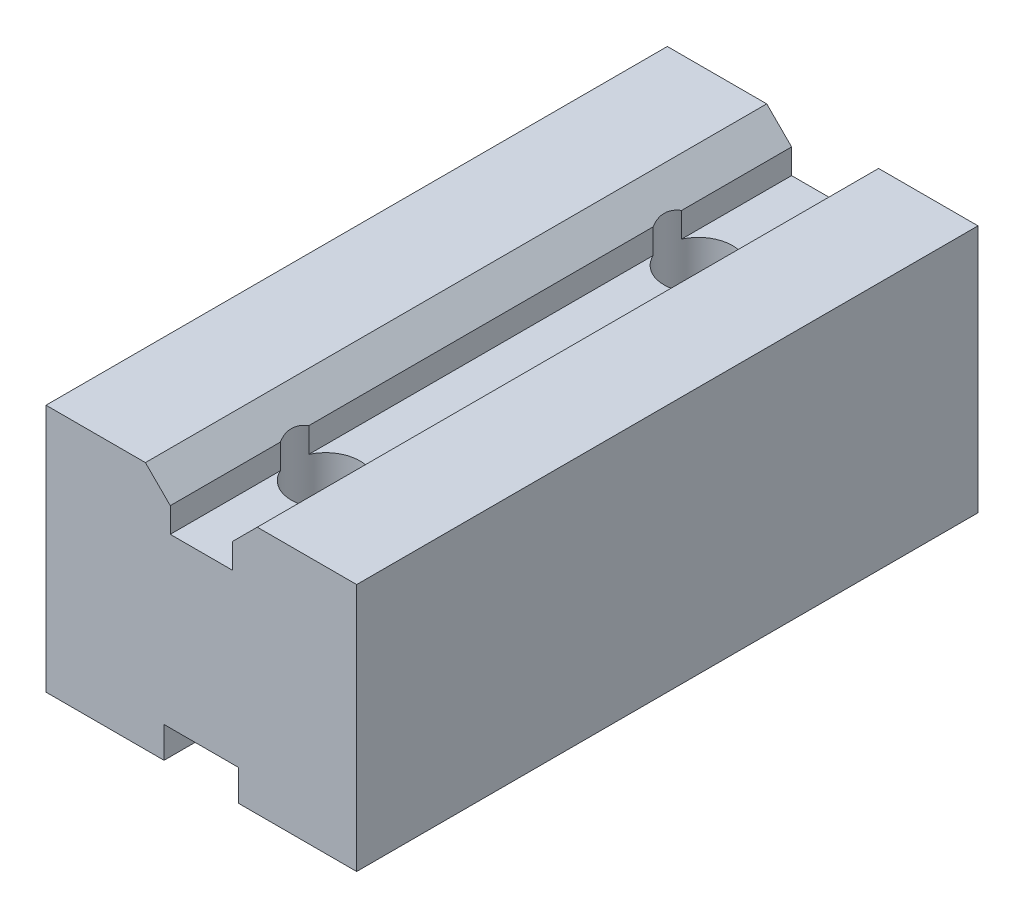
SolidWorks part; units mm, degrees
ref_plane "Ebene vorne" through (0, 0, 0) normal (0, 0, 1) x (1, 0, 0)
ref_plane "Ebene oben" through (0, 0, 0) normal (0, 1, 0) x (1, 0, 0)
ref_plane "Ebene rechts" through (0, 0, 0) normal (1, 0, 0) x (0, 0, -1)
sketch "Skizze1" plane through (0, 0, 0) normal (0, 0, 1) x (1, 0, 0)
  line L0 (0, 10.1887) -> (0, -17.0748) construction
  line L1 (12.5, -13.4678) -> (-12.5, -13.4678)
  line L2 (-12.5, -13.4678) -> (-12.5, 6.5322)
  line L3 (-12.5, 6.5322) -> (-4.5, 6.5322)
  line L4 (-4.5, 6.5322) -> (-2.5, 4.5322)
  line L5 (-2.5, 4.5322) -> (-2.5, 2.5322)
  line L6 (-2.5, 2.5322) -> (2.5, 2.5322)
  line L7 (2.5, 4.5322) -> (2.5, 2.5322)
  line L8 (4.5, 6.5322) -> (2.5, 4.5322)
  line L9 (12.5, 6.5322) -> (4.5, 6.5322)
  line L10 (12.5, -13.4678) -> (12.5, 6.5322)
  point P11 (0, 2.5322)
  point P15 (0, -13.4678)
  dimension "D1" = 25
  dimension "D2" = 20
  dimension "D3" = 4
  dimension "D4" = 2
  dimension "D5" = 45
  dimension "D6" = 5
extrude "Aufsatz-Linear austragen1" add sketch "Skizze1" along normal mid plane 50
sketch "Skizze2" plane through (0, 0, 25) normal (0, 0, 1) x (1, 0, 0)
  line L0 (0, 2.5322) -> (0, -13.4678) construction
  line L1 (2.5, 2.5322) -> (-2.5, 2.5322) construction
  line L2 (-12.5, -13.4678) -> (12.5, -13.4678) construction
  line L3 (-3, -13.4678) -> (-3, -10.9678)
  line L4 (-3, -10.9678) -> (3, -10.9678)
  line L5 (3, -10.9678) -> (3, -13.4678)
  line L6 (3, -13.4678) -> (-3, -13.4678)
  dimension "D1" = 2.5
  dimension "D2" = 6
extrude "Schnitt-Linear austragen1" cut sketch "Skizze2" against normal through all
hole_wizard "Stirnsenkung für M2.5 Zylinderschraube mit Innensechskant1" positions "Skizze5" profile "Skizze4" counterbore size "M2.5" standard "DIN"
sketch "Skizze5" plane through (0, 6.5322, 0) normal (0, 1, 0) x (1, 0, 0)
  line L0 (0, -25) -> (0, 25) construction
  line L1 (2.5, -25) -> (-2.5, -25) construction
  line L2 (2.5, 25) -> (-2.5, 25) construction
  line L4 (-12.5, 0) -> (12.5, 0) construction
  line L5 (-12.5, -25) -> (-12.5, 25) construction
  line L6 (12.5, -25) -> (12.5, 25) construction
  point P0 (0, 15)
  point P18 (0, -15)
  dimension "D1" = 30
sketch "Skizze4" plane through (0, 6.5322, -15) normal (1, 0, 0) x (0, 0, 1)
  line L0 (0, 0) -> (0, 20)
  line L1 (0, 20) -> (1.45, 20)
  line L3 (1.45, 20) -> (1.45, 10)
  line L4 (1.45, 10) -> (2.75, 10)
  line L5 (2.75, 10) -> (2.75, 0)
  line L7 (2.75, 0) -> (0, 0)
  line L11 (0, -6.35) -> (0, 107.95) construction
  dimension "Bohrerdurchmesser" = 2.9
  dimension "Bohrungstiefe" = 20
  dimension "Senkdurchmesser2" = 5.5
  dimension "Senktiefe2" = 10
sketch "Skizze6" [suppressed] plane through (0, 0, 27.5) normal (0, 0, 1) x (1, 0, 0)
  line L0 (0, 2.5322) -> (0, -16.4484) construction
  line L1 (2.5, 2.5322) -> (-2.5, 2.5322) construction
  line L2 (-3, -13.4678) -> (-3, -15.9678)
  line L3 (-12.5, -13.4678) -> (12.5, -13.4678) construction
  line L4 (-3, -15.9678) -> (3, -15.9678)
  line L5 (3, -15.9678) -> (3, -13.4678)
  line L6 (3, -13.4678) -> (-3, -13.4678)
  dimension "D1" = 2.5
  dimension "D2" = 6
extrude "Aufsatz-Linear austragen2" [suppressed] add sketch "Skizze6" against normal through all
hole_wizard "Stirnsenkung für M2.5 Zylinderschraube mit Innensechskant2" positions "Skizze8" profile "Skizze7" counterbore size "M2.5" standard "DIN"
sketch "Skizze8" plane through (0, 6.5322, 0) normal (0, 1, 0) x (1, 0, 0)
  point P0 (0, 0)
sketch "Skizze7" plane through (0, 6.5322, 0) normal (1, 0, 0) x (0, 0, 1)
  line L0 (0, 0) -> (0, 22.5)
  line L1 (0, 22.5) -> (1.45, 22.5)
  line L3 (1.45, 22.5) -> (1.45, 10)
  line L4 (1.45, 10) -> (2.75, 10)
  line L5 (2.75, 10) -> (2.75, 0)
  line L7 (2.75, 0) -> (0, 0)
  line L11 (0, -6.35) -> (0, 107.95) construction
  dimension "Bohrerdurchmesser" = 2.9
  dimension "Bohrungstiefe" = 22.5
  dimension "Senkdurchmesser2" = 5.5
  dimension "Senktiefe2" = 10
